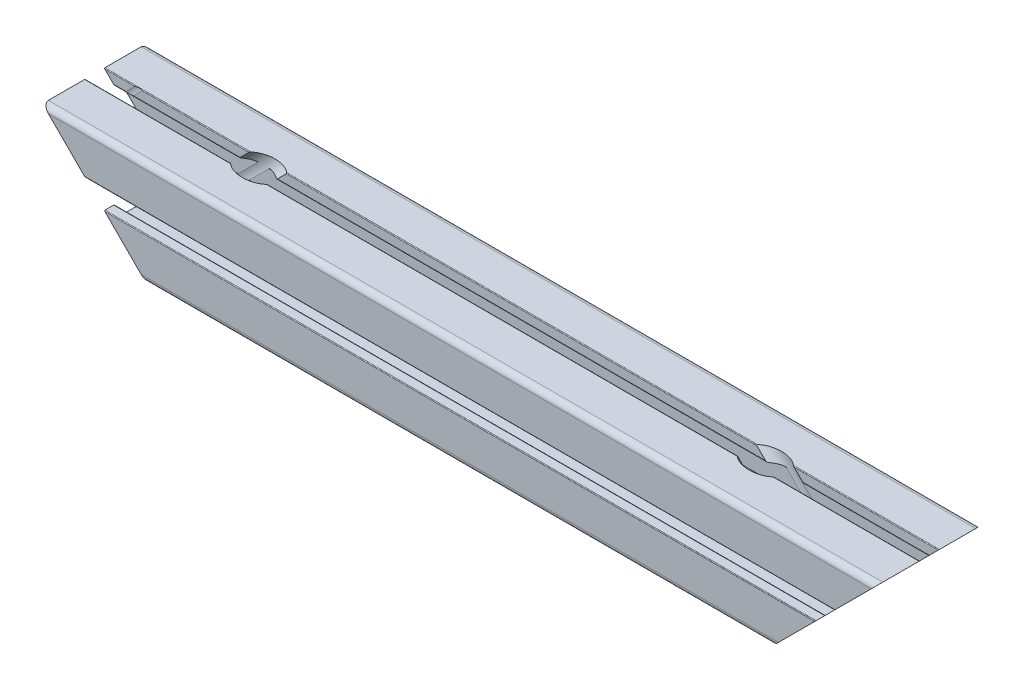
SolidWorks part; units mm, degrees
ref_plane "Front Plane" through (0, 0, 0) normal (0, 0, 1) x (1, 0, 0)
ref_plane "Top Plane" through (0, 0, 0) normal (0, 1, 0) x (1, 0, 0)
ref_plane "Right Plane" through (0, 0, 0) normal (1, 0, 0) x (0, 0, -1)
sketch3d "3DSketch1"
  line L0 (0, 0, 0) -> (-360, 0, 0)
  dimension "D1" = 360
other "45-sarja 1.0023 45X45(1)"
ref_plane "Plane2" through (0, 0, 0) normal (-1, 0, 0) x (0, 0, 1)
sketch "Model" plane through (0, 0, 0) normal (-1, 0, 0) x (0, 0, 1)
  line L0 (3.3633, 1.9491) -> (4.3841, 2.9698)
  line L1 (4.3841, 3.3941) -> (3.3941, 4.3841)
  line L2 (2.9698, 4.3841) -> (1.9491, 3.3633)
  line L3 (-1.9491, 3.3633) -> (-2.9698, 4.3841)
  line L4 (-3.3941, 4.3841) -> (-4.3841, 3.3941)
  line L5 (-4.3841, 2.9698) -> (-3.3633, 1.9491)
  line L6 (-3.3633, -1.9491) -> (-4.3841, -2.9698)
  line L7 (-4.3841, -3.3941) -> (-3.3941, -4.3841)
  line L8 (-2.9698, -4.3841) -> (-1.9491, -3.3633)
  line L9 (1.9491, -3.3633) -> (2.9698, -4.3841)
  line L10 (3.3941, -4.3841) -> (4.3841, -3.3941)
  line L11 (4.3841, -2.9698) -> (3.3633, -1.9491)
  line L12 (22.5, -20) -> (22.5, -4.4)
  line L13 (4.4, -22.5) -> (20, -22.5)
  line L14 (4.1, -18.5) -> (4.1, -22.2)
  line L15 (6.5, -18) -> (4.6, -18)
  line L16 (6.8, -9.2) -> (6.8, -17.7)
  line L17 (4.8, -7.2) -> (6.8, -9.2)
  line L18 (-4.8, -7.2) -> (4.8, -7.2)
  line L19 (-6.8, -9.2) -> (-4.8, -7.2)
  line L20 (-6.8, -17.7) -> (-6.8, -9.2)
  line L21 (-4.6, -18) -> (-6.5, -18)
  line L22 (-4.1, -22.2) -> (-4.1, -18.5)
  line L23 (-20, -22.5) -> (-4.4, -22.5)
  line L24 (-22.5, -4.4) -> (-22.5, -20)
  line L25 (-18.5, -4.1) -> (-22.2, -4.1)
  line L26 (-18, -6.5) -> (-18, -4.6)
  line L27 (-9.2, -6.8) -> (-17.7, -6.8)
  line L28 (-7.2, -4.8) -> (-9.2, -6.8)
  line L29 (-7.2, 4.8) -> (-7.2, -4.8)
  line L30 (-9.2, 6.8) -> (-7.2, 4.8)
  line L31 (-17.7, 6.8) -> (-9.2, 6.8)
  line L32 (-18, 4.6) -> (-18, 6.5)
  line L33 (-22.2, 4.1) -> (-18.5, 4.1)
  line L34 (-22.5, 20) -> (-22.5, 4.4)
  line L35 (-4.4, 22.5) -> (-20, 22.5)
  line L36 (-4.1, 18.5) -> (-4.1, 22.2)
  line L37 (-6.5, 18) -> (-4.6, 18)
  line L38 (-6.8, 9.2) -> (-6.8, 17.7)
  line L39 (-4.8, 7.2) -> (-6.8, 9.2)
  line L40 (4.8, 7.2) -> (-4.8, 7.2)
  line L41 (6.8, 9.2) -> (4.8, 7.2)
  line L42 (6.8, 17.7) -> (6.8, 9.2)
  line L43 (4.6, 18) -> (6.5, 18)
  line L44 (4.1, 22.2) -> (4.1, 18.5)
  line L45 (20, 22.5) -> (4.4, 22.5)
  line L46 (22.5, 4.4) -> (22.5, 20)
  line L47 (18.5, 4.1) -> (22.2, 4.1)
  line L48 (18, 6.5) -> (18, 4.6)
  line L49 (9.2, 6.8) -> (17.7, 6.8)
  line L50 (7.2, 4.8) -> (9.2, 6.8)
  line L51 (7.2, -4.8) -> (7.2, 4.8)
  line L52 (9.2, -6.8) -> (7.2, -4.8)
  line L53 (17.7, -6.8) -> (9.2, -6.8)
  line L54 (18, -4.6) -> (18, -6.5)
  line L55 (22.2, -4.1) -> (18.5, -4.1)
  circle A0 centre (14.65, 14.65) radius 5.85
  circle A1 centre (-14.65, -14.65) radius 5.85
  arc A2 (4.3841, 2.9698) -> (4.3841, 3.3941) centre (4.1719, 3.182) ccw
  arc A3 (3.3941, 4.3841) -> (2.9698, 4.3841) centre (3.182, 4.1719) ccw
  arc A4 (1.6059, 3.3056) -> (1.9491, 3.3633) centre (1.7369, 3.5754) ccw
  arc A5 (1.6059, 3.3056) -> (-1.6059, 3.3056) centre (0, 0) ccw
  arc A6 (-1.9491, 3.3633) -> (-1.6059, 3.3056) centre (-1.7369, 3.5754) ccw
  arc A7 (-2.9698, 4.3841) -> (-3.3941, 4.3841) centre (-3.182, 4.1719) ccw
  arc A8 (-4.3841, 3.3941) -> (-4.3841, 2.9698) centre (-4.1719, 3.182) ccw
  arc A9 (-3.3056, 1.6059) -> (-3.3633, 1.9491) centre (-3.5754, 1.7369) ccw
  arc A10 (-3.3056, 1.6059) -> (-3.3056, -1.6059) centre (0, 0) ccw
  arc A11 (-3.3633, -1.9491) -> (-3.3056, -1.6059) centre (-3.5754, -1.7369) ccw
  arc A12 (-4.3841, -2.9698) -> (-4.3841, -3.3941) centre (-4.1719, -3.182) ccw
  arc A13 (-3.3941, -4.3841) -> (-2.9698, -4.3841) centre (-3.182, -4.1719) ccw
  arc A14 (-1.6059, -3.3056) -> (-1.9491, -3.3633) centre (-1.7369, -3.5754) ccw
  arc A15 (-1.6059, -3.3056) -> (1.6059, -3.3056) centre (0, 0) ccw
  arc A16 (1.9491, -3.3633) -> (1.6059, -3.3056) centre (1.7369, -3.5754) ccw
  arc A17 (2.9698, -4.3841) -> (3.3941, -4.3841) centre (3.182, -4.1719) ccw
  arc A18 (4.3841, -3.3941) -> (4.3841, -2.9698) centre (4.1719, -3.182) ccw
  arc A19 (3.3056, -1.6059) -> (3.3633, -1.9491) centre (3.5754, -1.7369) ccw
  arc A20 (3.3056, -1.6059) -> (3.3056, 1.6059) centre (0, 0) ccw
  arc A21 (3.3633, 1.9491) -> (3.3056, 1.6059) centre (3.5754, 1.7369) ccw
  arc A22 (20, -22.5) -> (22.5, -20) centre (20, -20) ccw
  arc A23 (4.1, -22.2) -> (4.4, -22.5) centre (4.4, -22.2) ccw
  arc A24 (4.6, -18) -> (4.1, -18.5) centre (4.6, -18.5) ccw
  arc A25 (6.5, -18) -> (6.8, -17.7) centre (6.5, -17.7) ccw
  arc A26 (-6.8, -17.7) -> (-6.5, -18) centre (-6.5, -17.7) ccw
  arc A27 (-4.1, -18.5) -> (-4.6, -18) centre (-4.6, -18.5) ccw
  arc A28 (-4.4, -22.5) -> (-4.1, -22.2) centre (-4.4, -22.2) ccw
  arc A29 (-22.5, -20) -> (-20, -22.5) centre (-20, -20) ccw
  arc A30 (-22.2, -4.1) -> (-22.5, -4.4) centre (-22.2, -4.4) ccw
  arc A31 (-18, -4.6) -> (-18.5, -4.1) centre (-18.5, -4.6) ccw
  arc A32 (-18, -6.5) -> (-17.7, -6.8) centre (-17.7, -6.5) ccw
  arc A33 (-17.7, 6.8) -> (-18, 6.5) centre (-17.7, 6.5) ccw
  arc A34 (-18.5, 4.1) -> (-18, 4.6) centre (-18.5, 4.6) ccw
  arc A35 (-22.5, 4.4) -> (-22.2, 4.1) centre (-22.2, 4.4) ccw
  arc A36 (-20, 22.5) -> (-22.5, 20) centre (-20, 20) ccw
  arc A37 (-4.1, 22.2) -> (-4.4, 22.5) centre (-4.4, 22.2) ccw
  arc A38 (-4.6, 18) -> (-4.1, 18.5) centre (-4.6, 18.5) ccw
  arc A39 (-6.5, 18) -> (-6.8, 17.7) centre (-6.5, 17.7) ccw
  arc A40 (6.8, 17.7) -> (6.5, 18) centre (6.5, 17.7) ccw
  arc A41 (4.1, 18.5) -> (4.6, 18) centre (4.6, 18.5) ccw
  arc A42 (4.4, 22.5) -> (4.1, 22.2) centre (4.4, 22.2) ccw
  arc A43 (22.5, 20) -> (20, 22.5) centre (20, 20) ccw
  arc A44 (22.2, 4.1) -> (22.5, 4.4) centre (22.2, 4.4) ccw
  arc A45 (18, 4.6) -> (18.5, 4.1) centre (18.5, 4.6) ccw
  arc A46 (18, 6.5) -> (17.7, 6.8) centre (17.7, 6.5) ccw
  arc A47 (17.7, -6.8) -> (18, -6.5) centre (17.7, -6.5) ccw
  arc A48 (18.5, -4.1) -> (18, -4.6) centre (18.5, -4.6) ccw
  arc A49 (22.5, -4.4) -> (22.2, -4.1) centre (22.2, -4.4) ccw
  circle A50 centre (14.65, -14.65) radius 5.85
  circle A51 centre (-14.65, 14.65) radius 5.85
  point P157 (0, 0)
  point P158 (-22.5, 22.5)
  point P159 (0, 22.5)
  point P160 (22.5, 0)
  point P161 (22.5, 22.5)
  point P162 (-22.5, 0)
  point P163 (-22.5, -22.5)
  point P164 (0, -22.5)
  point P165 (22.5, -22.5)
  point P166 (0, 0)
sketch "Sketch3" plane through (0, 0, 22.5) normal (0, 0, 1) x (1, 0, 0)
  line L0 (0, 22.5) -> (-45, -22.5)
  line L1 (-360, -22.5) -> (0, -22.5) construction
  line L2 (-45, -22.5) -> (10.3987, -32.8987)
  line L3 (10.3987, -32.8987) -> (0, 22.5)
extrude "Cut-Extrude1" cut sketch "Sketch3" against normal through all
sketch "Sketch4" plane through (0, 0, 22.5) normal (0, 0, 1) x (1, 0, 0)
  line L0 (-360, 22.5) -> (-315, -22.5)
  line L1 (-360, -22.5) -> (-45, -22.5) construction
  line L2 (-315, -22.5) -> (-360, -22.5)
  line L3 (-360, -22.5) -> (-360, 22.5)
  point P5 (-360.1123, -22.8151)
  point P8 (0, 0)
  point P9 (0, 0)
  dimension "D1" = 45
extrude "Cut-Extrude2" cut sketch "Sketch4" against normal through all
sketch "Sketch5" plane through (-11.25, 11.25, 0) normal (0.7071, -0.7071, 0) x (0, 0, -1)
  point P0 (0, -15.9099)
hole_wizard "Ø8.5 (8.5) Diameter Hole1" positions "Sketch5" profile "Sketch6" hole size "Ø8.5" standard "DIN"
sketch "Sketch6" plane through (-22.5, 0, 0) normal (0, 0, 1) x (0.7071, 0.7071, 0)
  line L0 (0, 0) -> (0, 254.5584)
  line L1 (0, 254.5584) -> (4.25, 254.5584)
  line L2 (4.25, 254.5584) -> (4.25, 0)
  line L5 (4.25, 0) -> (0, 0)
  line L11 (0, -6.35) -> (0, 107.95) construction
  dimension "Thru Hole Dia." = 8.5
  dimension "Thru Hole Depth" = 254.5584
ref_plane "Plane3" through (-51.5551, 51.5551, 0) normal (0.7071, -0.7071, 0) x (0, 0, -1)
sketch "Sketch11" plane through (-51.5551, 51.5551, 0) normal (0.7071, -0.7071, 0) x (0, 0, -1)
  line L0 (4.4, 15.9099) -> (20, 15.9099) construction
  point P6 (0, -34.0901)
  dimension "D1" = 50
hole_wizard "CBORE for M8 Hex Head Bolt4" positions "Sketch11" profile "Sketch13" counterbore size "M8" standard "DIN"
sketch "Sketch13" plane through (-75.6604, 27.4497, 0) normal (0, 0, 1) x (-0.7071, -0.7071, 0)
  line L0 (0, 0) -> (0, 88.8198)
  line L1 (0, 88.8198) -> (4.2, 88.8198)
  line L3 (4.2, 88.8198) -> (4.2, 32.5)
  line L4 (4.2, 32.5) -> (7, 32.5)
  line L5 (7, 32.5) -> (7, 0)
  line L7 (7, 0) -> (0, 0)
  line L11 (0, -6.35) -> (0, 107.95) construction
  dimension "Thru Hole Dia." = 8.4
  dimension "Thru Hole Depth" = 88.8198
  dimension "C'Bore Dia." = 14
  dimension "C'Bore Depth" = 32.5
sketch "Sketch17" plane through (-168.75, -168.75, 0) normal (-0.7071, -0.7071, 0) x (0, 0, 1)
  point P0 (0, 259.8617)
hole_wizard "Ø8.5 (8.5) Diameter Hole2" positions "Sketch17" profile "Sketch18" hole size "Ø8.5" standard "DIN"
sketch "Sketch18" plane through (-352.5, 15, 0) normal (0, 0, 1) x (0.7071, -0.7071, 0)
  line L0 (0, 0) -> (0, 254.5584)
  line L1 (0, 254.5584) -> (4.25, 254.5584)
  line L2 (4.25, 254.5584) -> (4.25, 0)
  line L5 (4.25, 0) -> (0, 0)
  line L11 (0, -6.35) -> (0, 107.95) construction
  dimension "Thru Hole Dia." = 8.5
  dimension "Thru Hole Depth" = 254.5584
ref_plane "Plane4" through (-140.4657, -140.4657, 0) normal (-0.7071, -0.7071, 0) x (-0.7071, 0.7071, 0)
sketch "Sketch19" plane through (-140.4657, -140.4657, 0) normal (-0.7071, -0.7071, 0) x (-0.7071, 0.7071, 0)
  point P0 (259.8617, 0)
hole_wizard "CBORE for M8 Hex Head Bolt5" positions "Sketch19" profile "Sketch20" counterbore size "M8" standard "DIN"
sketch "Sketch20" plane through (-324.2157, 43.2843, 0) normal (0, 0, 1) x (-0.7071, 0.7071, 0)
  line L0 (0, 0) -> (0, 71.8198)
  line L1 (0, 71.8198) -> (4.2, 71.8198)
  line L3 (4.2, 71.8198) -> (4.2, 36.5)
  line L4 (4.2, 36.5) -> (7, 36.5)
  line L5 (7, 36.5) -> (7, 0)
  line L7 (7, 0) -> (0, 0)
  line L11 (0, -6.35) -> (0, 107.95) construction
  dimension "Thru Hole Dia." = 8.4
  dimension "Thru Hole Depth" = 71.8198
  dimension "C'Bore Dia." = 14
  dimension "C'Bore Depth" = 36.5
ref_plane "Plane5" through (-180, 0, 0) normal (1, 0, 0) x (0, 0, -1)
mirror "Mirror1" about plane through (-180, 0, 0) normal (1, 0, 0) of "CBORE for M8 Hex Head Bolt4"
